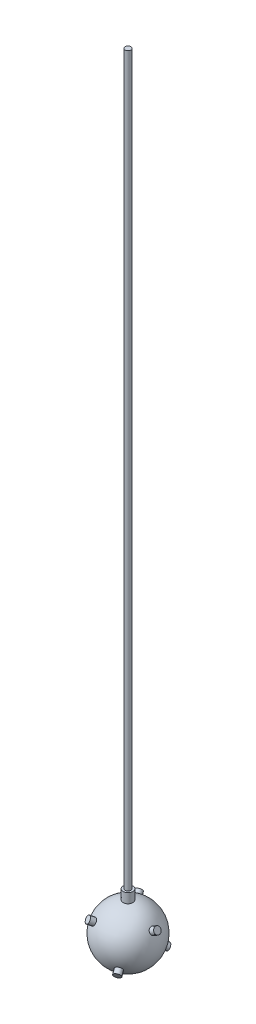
SolidWorks part; units mm, degrees
ref_plane "Alzado" through (0, 0, 0) normal (0, 0, 1) x (1, 0, 0)
ref_plane "Planta" through (0, 0, 0) normal (0, 1, 0) x (1, 0, 0)
ref_plane "Vista lateral" through (0, 0, 0) normal (1, 0, 0) x (0, 0, -1)
sketch "Croquis1" plane through (0, 0, 0) normal (0, 0, 1) x (1, 0, 0)
  line L0 (0, -60) -> (0, 60)
  arc A0 (0, -60) -> (0, 60) centre (0, 0) ccw
  dimension "D1" = 120
revolve "Revolución1" add sketch "Croquis1" angle 360 about L0
sketch "Croquis2" plane through (0, 0, 0) normal (0, 0, 1) x (1, 0, 0)
  line L0 (0, 0) -> (0, 102.327) construction
  line L2 (0, 79.1608) -> (10, 79.1608)
  line L3 (0, 79.1608) -> (0, 59.1608)
  line L4 (0, 59.1608) -> (10, 59.1608)
  line L5 (10, 79.1608) -> (10, 59.1608)
  circle A0 centre (0, 0) radius 60 construction
  dimension "D1" = 10
  dimension "D2" = 20
sketch "Croquis4" plane through (0, 0, 0) normal (0, 1, 0) x (1, 0, 0)
  line L0 (-30, 51.9615) -> (30, -51.9615)
  line L1 (30, 51.9615) -> (-30, -51.9615)
  line L2 (60, 0) -> (-60, 0)
  circle A0 centre (0, 0) radius 60 construction
ref_plane "Plano1" through (0, 0, 0) normal (-0.866, 0, -0.5) x (-0.5, 0, 0.866)
ref_plane "Plano2" through (0, 0, 0) normal (-0.866, 0, 0.5) x (0.5, 0, 0.866)
sketch "Croquis149" plane through (0, 0, 0) normal (1, 0, 0) x (0, 0, -1)
  circle A0 centre (0, 0) radius 6
  dimension "D1" = 12
sketch "Croquis150" plane through (0, 0, 0) normal (0, 1, 0) x (1, 0, 0)
  circle A0 centre (0, 0) radius 6
  dimension "D1" = 12
sketch "Croquis151" plane through (0, 0, 0) normal (0, 0, 1) x (1, 0, 0)
  circle A0 centre (0, 0) radius 6
  dimension "D1" = 12
sketch "Croquis152" plane through (0, 0, 0) normal (0, 0, 1) x (1, 0, 0)
  line L0 (0, 0) -> (60.6218, 35)
  line L1 (0, 0) -> (-60.6218, -35)
  line L2 (0, 0) -> (0, 104.5703) construction
  dimension "D1" = 70
  dimension "D2" = 70
  dimension "D3" = 60
  dimension "D4" = 120
revolve "Revolución2" add sketch "Croquis2" angle 360 about L0
sketch "Croquis164" plane through (0, 79.1608, 0) normal (0, 1, 0) x (1, 0, 0)
  circle A0 centre (0, 0) radius 6
  dimension "D1" = 12
extrude "Saliente-Extruir1" add sketch "Croquis164" along normal blind 1500
sweep "Barrer1" add path "Croquis152" parameters "D3"=14
pattern_circular "MatrizC2" count 3 over 360 about axis through (0, 0, 0) along (0, 1, 0)
